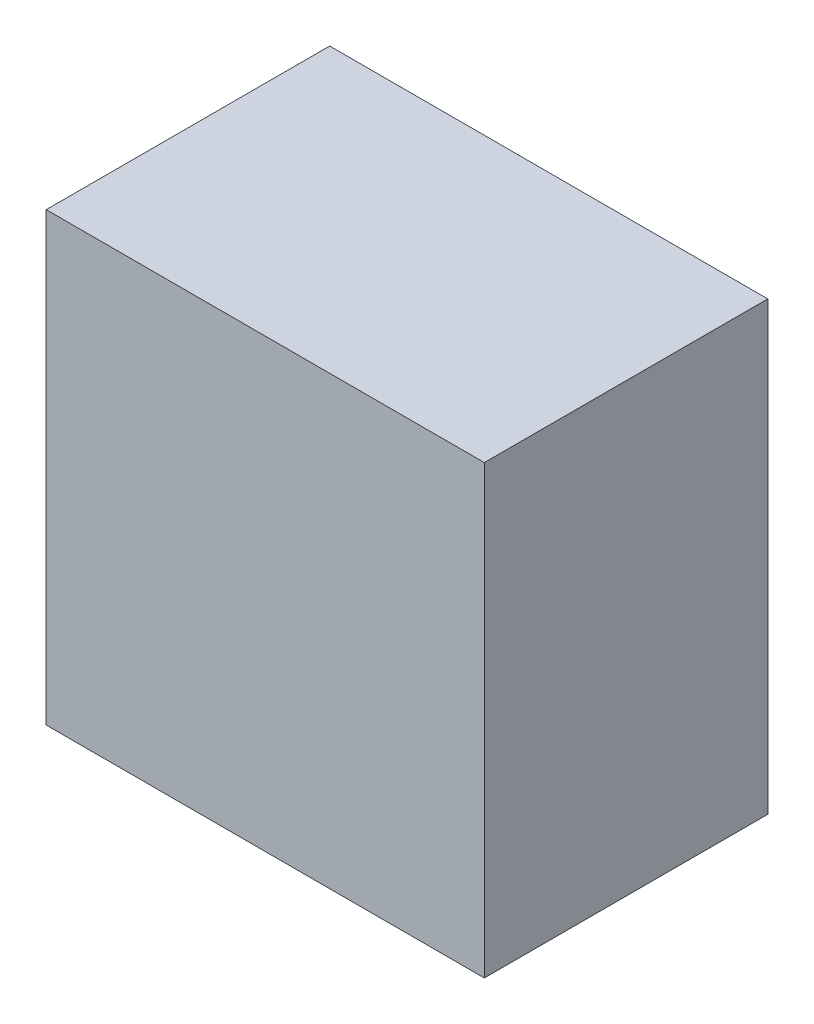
SolidWorks part; units mm, degrees
ref_plane "Front Plane" through (0, 0, 0) normal (0, 0, 1) x (1, 0, 0)
ref_plane "Top Plane" through (0, 0, 0) normal (0, 1, 0) x (1, 0, 0)
ref_plane "Right Plane" through (0, 0, 0) normal (1, 0, 0) x (0, 0, -1)
sketch "Sketch1" plane through (0, 0, 0) normal (0, 0, 1) x (1, 0, 0)
  line L1 (0, 0) -> (78.5091, 0)
  line L2 (0, 0) -> (0, 79.996)
  line L3 (0, 79.996) -> (78.5091, 79.996)
  line L4 (78.5091, 0) -> (78.5091, 79.996)
extrude "Extrude1" add sketch "Sketch1" along normal blind 50.8
